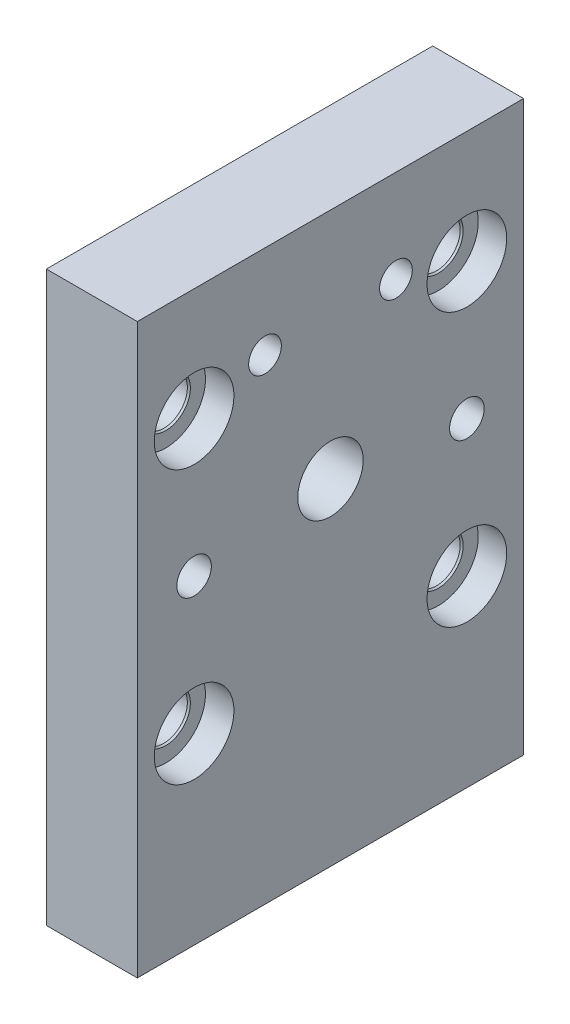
SolidWorks part; units mm, degrees
ref_plane "Front Plane" through (0, 0, 0) normal (0, 0, 1) x (1, 0, 0)
ref_plane "Top Plane" through (0, 0, 0) normal (0, 1, 0) x (1, 0, 0)
ref_plane "Right Plane" through (0, 0, 0) normal (1, 0, 0) x (0, 0, -1)
sketch "Sketch1" plane through (0, 0, 0) normal (1, 0, 0) x (0, 0, -1)
  line L0 (-13.4874, 0) -> (13.4874, 0)
  line L1 (13.4874, 0) -> (13.4874, 39.7002)
  line L2 (13.4874, 39.7002) -> (-13.4874, 39.7002)
  line L3 (-13.4874, 39.7002) -> (-13.4874, 0)
  circle A0 centre (9.525, 22.3266) radius 1.2065
  circle A1 centre (0, 23.4442) radius 2.286
  circle A2 centre (-9.525, 22.3266) radius 1.2065
extrude "Extrude1" add sketch "Sketch1" along normal blind 6.35
sketch "Sketch2" plane through (0, 0, 0) normal (1, 0, 0) x (0, 0, -1)
  circle A0 centre (0, 10.5156) radius 2.794
extrude "Cut-Extrude1" cut sketch "Sketch2" along normal blind 3.175
sketch "Sketch3" plane through (0, 0, 0) normal (1, 0, 0) x (0, 0, -1)
  circle A0 centre (0, 29.7434) radius 2.794
sketch "Sketch4" plane through (0, 0, 0) normal (1, 0, 0) x (0, 0, -1)
  circle A0 centre (0, 36.0934) radius 2.794
extrude "Cut-Extrude2" cut sketch "Sketch3" along normal blind 3.175
extrude "Cut-Extrude3" cut sketch "Sketch4" along normal blind 3.175
sketch "Sketch5" plane through (0, 0, 0) normal (0, 0, 1) x (1, 0, 0)
  line L0 (0, 10.5156) -> (0, 12.5476)
  line L1 (0.508, 13.0556) -> (3.175, 13.0556)
  line L2 (3.175, 13.0556) -> (3.175, 10.5156)
  line L3 (3.175, 10.5156) -> (0, 10.5156)
  line L4 (3.175, 10.5156) -> (0, 10.5156) construction
  arc A0 (0, 12.5476) -> (0.508, 13.0556) centre (0.508, 12.5476) cw
revolve "Revolve1" add sketch "Sketch5" angle 360 about L4
ref_plane "Plane1" through (3.175, 0, 0) normal (1, 0, 0) x (0, 0, -1)
ref_plane "Plane2" through (0, 0, 0) normal (0, 0, 1) x (1, 0, 0)
ref_plane "Plane3" through (0, 0, 0) normal (0, 0, 1) x (1, 0, 0)
sketch "Sketch6" plane through (0, 0, 0) normal (0, 0, 1) x (1, 0, 0)
  line L0 (0, 36.0934) -> (0, 38.1254)
  line L1 (0.508, 38.6334) -> (3.175, 38.6334)
  line L2 (3.175, 38.6334) -> (3.175, 36.0934)
  line L3 (3.175, 36.0934) -> (0, 36.0934)
  line L4 (3.175, 36.0934) -> (0, 36.0934) construction
  arc A0 (0, 38.1254) -> (0.508, 38.6334) centre (0.508, 38.1254) cw
sketch "Sketch7" plane through (0, 0, 0) normal (0, 0, 1) x (1, 0, 0)
  line L0 (0, 29.7434) -> (0, 31.7754)
  line L1 (0.508, 32.2834) -> (3.175, 32.2834)
  line L2 (3.175, 32.2834) -> (3.175, 29.7434)
  line L3 (3.175, 29.7434) -> (0, 29.7434)
  line L4 (3.175, 29.7434) -> (0, 29.7434) construction
  arc A0 (0, 31.7754) -> (0.508, 32.2834) centre (0.508, 31.7754) cw
revolve "Revolve2" add sketch "Sketch6" angle 360 about L4
revolve "Revolve3" add sketch "Sketch7" angle 360 about L4
sketch "Sketch8" plane through (0, 0, 0) normal (1, 0, 0) x (0, 0, -1)
  line L0 (-1.5875, 11.4321) -> (-1.5875, 9.5991)
  line L1 (-1.5875, 9.5991) -> (0, 8.6825)
  line L2 (0, 8.6825) -> (1.5875, 9.5991)
  line L3 (1.5875, 9.5991) -> (1.5875, 11.4321)
  line L4 (1.5875, 11.4321) -> (0, 12.3487)
  line L5 (0, 12.3487) -> (-1.5875, 11.4321)
extrude "Cut-Extrude4" cut sketch "Sketch8" along normal blind 1.5875
sketch "Sketch9" plane through (0, 0, 0) normal (1, 0, 0) x (0, 0, -1)
  line L0 (-1.5875, 37.0099) -> (-1.5875, 35.1769)
  line L1 (-1.5875, 35.1769) -> (0, 34.2603)
  line L2 (0, 34.2603) -> (1.5875, 35.1769)
  line L3 (1.5875, 35.1769) -> (1.5875, 37.0099)
  line L4 (1.5875, 37.0099) -> (0, 37.9265)
  line L5 (0, 37.9265) -> (-1.5875, 37.0099)
sketch "Sketch10" plane through (0, 0, 0) normal (1, 0, 0) x (0, 0, -1)
  line L0 (-1.5875, 30.6599) -> (-1.5875, 28.8269)
  line L1 (-1.5875, 28.8269) -> (0, 27.9103)
  line L2 (0, 27.9103) -> (1.5875, 28.8269)
  line L3 (1.5875, 28.8269) -> (1.5875, 30.6599)
  line L4 (1.5875, 30.6599) -> (0, 31.5765)
  line L5 (0, 31.5765) -> (-1.5875, 30.6599)
extrude "Cut-Extrude5" cut sketch "Sketch9" along normal blind 1.5875
extrude "Cut-Extrude6" cut sketch "Sketch10" along normal blind 1.5875
ref_plane "Plane4" through (6.35, 0, 0) normal (1, 0, 0) x (0, 0, -1)
ref_plane "Plane5" through (0, 0, 9.525) normal (0, 0, 1) x (1, 0, 0)
sketch "Sketch11" plane through (0, 0, 9.525) normal (0, 0, 1) x (1, 0, 0)
  line L0 (0, 31.8516) -> (0, 33.5026)
  line L1 (0, 33.5026) -> (4.2333, 33.5026)
  line L2 (4.2333, 33.5026) -> (4.3653, 33.5788)
  line L3 (4.3653, 33.5788) -> (4.3653, 34.6329)
  line L4 (4.3653, 34.6329) -> (6.35, 34.6329)
  line L5 (6.35, 34.6329) -> (6.35, 31.8516)
  line L6 (6.35, 31.8516) -> (0, 31.8516)
  line L7 (6.35, 31.8516) -> (0, 31.8516) construction
revolve "Cut-Revolve1" cut sketch "Sketch11" angle 360 about L7
ref_plane "Plane6" through (0, 0, 9.525) normal (0, 0, 1) x (1, 0, 0)
ref_plane "Plane7" through (0, 0, -9.525) normal (0, 0, 1) x (1, 0, 0)
ref_plane "Plane8" through (0, 0, -9.525) normal (0, 0, 1) x (1, 0, 0)
sketch "Sketch12" plane through (0, 0, 9.525) normal (0, 0, 1) x (1, 0, 0)
  line L0 (0, 12.8016) -> (0, 14.4526)
  line L1 (0, 14.4526) -> (4.2333, 14.4526)
  line L2 (4.2333, 14.4526) -> (4.3653, 14.5288)
  line L3 (4.3653, 14.5288) -> (4.3653, 15.5829)
  line L4 (4.3653, 15.5829) -> (6.35, 15.5829)
  line L5 (6.35, 15.5829) -> (6.35, 12.8016)
  line L6 (6.35, 12.8016) -> (0, 12.8016)
  line L7 (6.35, 12.8016) -> (0, 12.8016) construction
sketch "Sketch13" plane through (0, 0, -9.525) normal (0, 0, 1) x (1, 0, 0)
  line L0 (0, 12.8016) -> (0, 14.4526)
  line L1 (0, 14.4526) -> (4.2333, 14.4526)
  line L2 (4.2333, 14.4526) -> (4.3653, 14.5288)
  line L3 (4.3653, 14.5288) -> (4.3653, 15.5829)
  line L4 (4.3653, 15.5829) -> (6.35, 15.5829)
  line L5 (6.35, 15.5829) -> (6.35, 12.8016)
  line L6 (6.35, 12.8016) -> (0, 12.8016)
  line L7 (6.35, 12.8016) -> (0, 12.8016) construction
sketch "Sketch14" plane through (0, 0, -9.525) normal (0, 0, 1) x (1, 0, 0)
  line L0 (0, 31.8516) -> (0, 33.5026)
  line L1 (0, 33.5026) -> (4.2333, 33.5026)
  line L2 (4.2333, 33.5026) -> (4.3653, 33.5788)
  line L3 (4.3653, 33.5788) -> (4.3653, 34.6329)
  line L4 (4.3653, 34.6329) -> (6.35, 34.6329)
  line L5 (6.35, 34.6329) -> (6.35, 31.8516)
  line L6 (6.35, 31.8516) -> (0, 31.8516)
  line L7 (6.35, 31.8516) -> (0, 31.8516) construction
revolve "Cut-Revolve2" cut sketch "Sketch12" angle 360 about L7
revolve "Cut-Revolve3" cut sketch "Sketch13" angle 360 about L7
revolve "Cut-Revolve4" cut sketch "Sketch14" angle 360 about L7
sketch "Sketch15" plane through (0, 0, 0) normal (1, 0, 0) x (0, 0, -1)
  circle A0 centre (4.572, 33.2232) radius 1.143
extrude "Cut-Extrude7" cut sketch "Sketch15" along normal blind 6.35
sketch "Sketch16" plane through (0, 0, 0) normal (1, 0, 0) x (0, 0, -1)
  circle A0 centre (-4.572, 33.2232) radius 1.143
extrude "Cut-Extrude8" cut sketch "Sketch16" along normal blind 6.35
